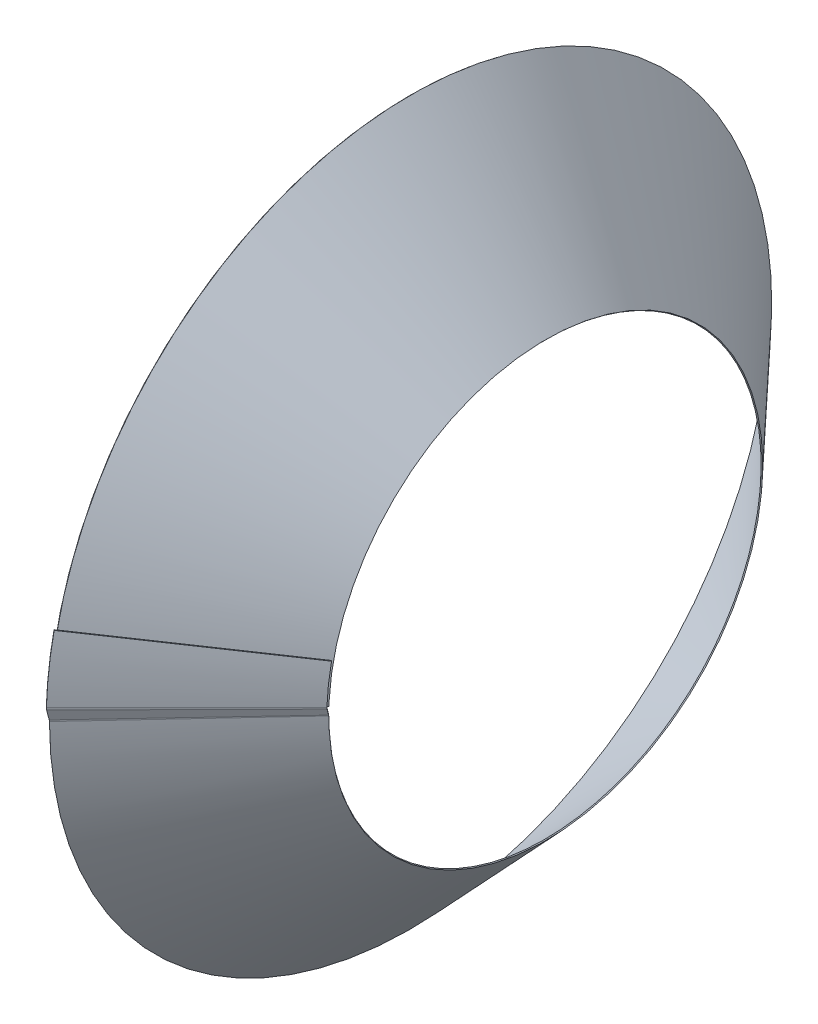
SolidWorks part; units mm, degrees
ref_plane "Vorne" through (0, 0, 0) normal (0, 0, 1) x (1, 0, 0)
ref_plane "Oben" through (0, 0, 0) normal (0, 1, 0) x (1, 0, 0)
ref_plane "Rechts" through (0, 0, 0) normal (1, 0, 0) x (0, 0, -1)
ref_plane "Ebene1" through (60, 0, 0) normal (1, 0, 0) x (0, 1, 0)
sketch "Skizze1" plane through (0, 0, 0) normal (1, 0, 0) x (0, -1, 0)
  line L0 (0, -160) -> (0, 0) construction
  line L1 (0, 0) -> (-5.5839, -159.9025) construction
  line L2 (-0.3797, -160.1017) -> (-4.7542, -161.2739)
  line L3 (-33.572, -157.9441) -> (0, 0) construction
  arc A0 (0.3895, -159.9995) -> (-5.5839, -159.9025) centre (0, 0) ccw
  arc A1 (-33.572, -157.9441) -> (-5.6353, -161.3743) centre (0, 0) ccw
  arc A2 (0.3895, -159.9995) -> (-0.3797, -160.1017) centre (0.3968, -162.9995) ccw
  arc A3 (-5.6353, -161.3743) -> (-4.7542, -161.2739) centre (-5.5306, -158.3761) ccw
  dimension "D1" = 160
  dimension "D5" = 3
  dimension "D6" = 1.4726
  dimension "D2" = 2
  dimension "D3" = 75
  dimension "D4" = 10
sheet metal parameters "Blech1" thickness 0.5 parameters "D1"=1, "Dicke"=0.5
sketch "Skizze5" plane through (60, 0, 0) normal (1, 0, 0) x (0, 1, 0)
  line L0 (0.3797, 160.1017) -> (4.7542, 161.2739) construction
  line L1 (0.3797, 160.1017) -> (4.7542, 161.2739) construction
  line L2 (0.2278, 96.061) -> (2.8525, 96.7643)
  arc A0 (33.572, 157.9441) -> (5.6353, 161.3743) centre (0, 0) ccw construction
  arc A1 (5.6353, 161.3743) -> (4.7542, 161.2739) centre (5.5306, 158.3761) ccw construction
  arc A2 (-0.3895, 159.9995) -> (5.5839, 159.9025) centre (0, 0) ccw construction
  arc A3 (-0.3895, 159.9995) -> (0.3797, 160.1017) centre (-0.3968, 162.9995) ccw construction
  arc A4 (33.572, 157.9441) -> (5.6353, 161.3743) centre (0, 0) ccw construction
  arc A5 (5.6353, 161.3743) -> (4.7542, 161.2739) centre (5.5306, 158.3761) ccw construction
  arc A6 (-0.3895, 159.9995) -> (5.5839, 159.9025) centre (0, 0) ccw construction
  arc A7 (-0.3895, 159.9995) -> (0.3797, 160.1017) centre (-0.3968, 162.9995) ccw construction
  arc A8 (20.1432, 94.7664) -> (3.3812, 96.8246) centre (0, 0) ccw
  arc A9 (-0.2337, 95.9997) -> (0.2278, 96.061) centre (-0.2381, 97.7997) ccw
  arc A10 (-0.2337, 95.9997) -> (3.3504, 95.9415) centre (0, 0) ccw
  arc A11 (3.3812, 96.8246) -> (2.8525, 96.7643) centre (3.3184, 95.0257) ccw
lofted bend "Ausgeformte Biegungen6" parameters "D1"=0, "D12"=0.5
other "Freiform-Biegung4" parameters "D1"=1000, "D4"=357.86, "D5"=1
other "Freiform-Biegung5" parameters "D1"=1000, "D4"=57.296, "D5"=2
other "Freiform-Biegung6" parameters "D1"=1000, "D4"=57.296, "D5"=3
other "Freiform-Biegung7" parameters "D1"=1000, "D4"=10.019, "D5"=4
flat pattern "Abwicklung3"
sketch "Biegung-Linien3" plane through (0, 0, 0) normal (0, 1, 0) x (-1, 0, 0)
other "Abwickeln-<Freiform-Biegung4>1"
other "Abwickeln-<Freiform-Biegung5>1"
other "Abwickeln-<Freiform-Biegung6>1"
other "Abwickeln-<Freiform-Biegung7>1"
